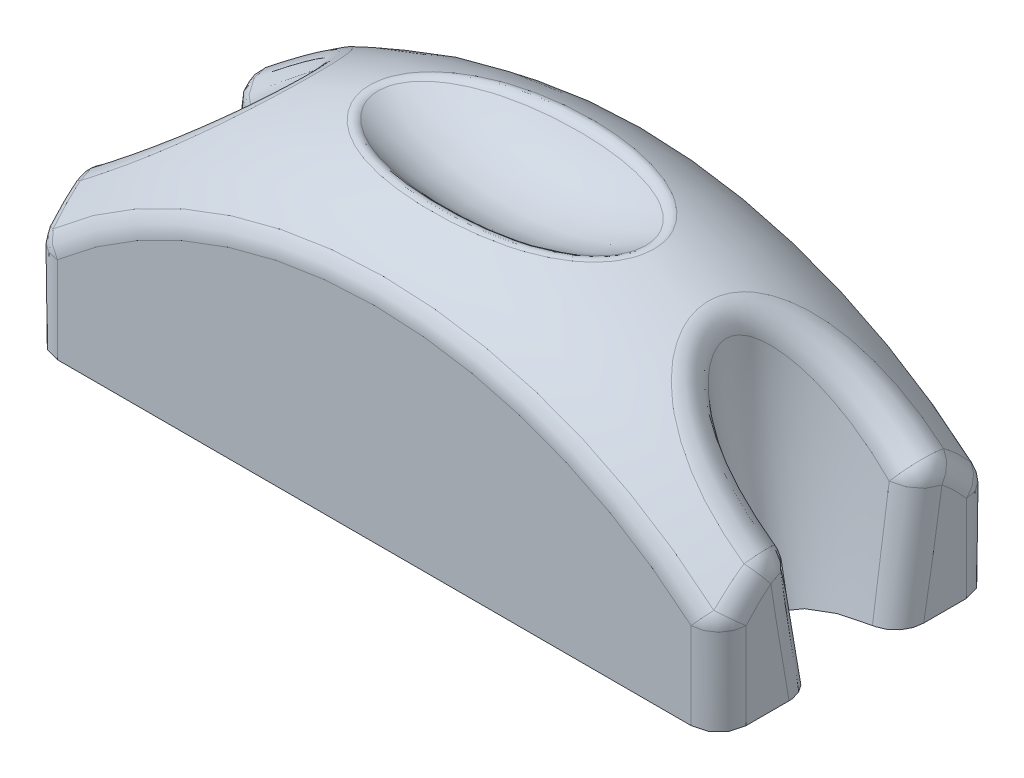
SolidWorks part; units mm, degrees
ref_plane "Front" through (0, 0, 0) normal (0, 0, 1) x (1, 0, 0)
ref_plane "Top" through (0, 0, 0) normal (0, 1, 0) x (1, 0, 0)
ref_plane "Right" through (0, 0, 0) normal (1, 0, 0) x (0, 0, -1)
sketch "Sketch1" plane through (0, 0, 0) normal (0, 1, 0) x (1, 0, 0)
  line L0 (62.5, 25) -> (-62.5, -25) construction
  line L1 (62.5, -25) -> (-62.5, -25)
  line L2 (62.5, -25) -> (62.5, 25)
  line L3 (62.5, 25) -> (-62.5, 25)
  line L4 (-62.5, -25) -> (-62.5, 25)
  dimension "D1" = 125
  dimension "D2" = 50
extrude "Extrude1" add sketch "Sketch1" along normal blind 50
sketch "Sketch2" plane through (0, 0, 0) normal (0, 0, 1) x (1, 0, 0)
  line L0 (62.5, 50) -> (62.5, 0) construction
  line L2 (-62.5, 0) -> (62.5, 0) construction
  line L4 (-62.5, 50) -> (-62.5, 0) construction
  arc A0 (62.5, 28) -> (-62.5, 28) centre (0, -50.0625) ccw
  dimension "D2" = 100
  dimension "D1" = 28
ref_plane "Plane1" through (62.5, 28, 0) normal (-0.7806, 0.625, 0) x (0, 0, 1)
sketch "Sketch3" plane through (62.5, 28, 0) normal (-0.7806, 0.625, 0) x (0, 0, 1)
  line L0 (-25, 17.1737) -> (-25, -60.9513) construction
  line L1 (25, -60.9513) -> (25, 17.1737) construction
  line L3 (-25, -10.5051) -> (-35.5007, -10.5051)
  line L4 (-35.5007, -10.5051) -> (-35.5007, 40.6396)
  line L5 (-35.5007, 40.6396) -> (37.2927, 40.6396)
  line L6 (37.2927, 40.6396) -> (37.2927, -10.5051)
  line L7 (37.2927, -10.5051) -> (25, -10.5051)
  arc A0 (-25, -10.5051) -> (25, -10.5051) centre (0, -35) cw
  dimension "D1" = 35
sweep "Cut-Sweep1" cut profiles "Sketch3" path "Sketch2"
sketch "Sketch4" plane through (0, 0, 0) normal (0, 1, 0) x (1, 0, 0)
  line L1 (62.5, -25) -> (62.5, 25) construction
  ellipse E0 centre (62.5, 0) end of major axis (47.5, 0) minor radius 7.5
  dimension "D1" = 30
  dimension "D2" = 15
ref_plane "Plane2" through (0, 50, 0) normal (0, 1, 0) x (-1, 0, 0)
sketch "Sketch5" plane through (0, 50, 0) normal (0, 1, 0) x (-1, 0, 0)
  line L0 (-62.5, 25) -> (-62.5, -25) construction
  ellipse E0 centre (-62.5, 0) end of major axis (-38.5, 0) minor radius 15
  dimension "D1" = 48
  dimension "D2" = 30
sketch "Sketch6" plane through (0, 0, 0) normal (0, 0, 1) x (1, 0, 0)
  arc A0 (47.5, 0) -> (38.5, 50) centre (178.4987, 49.3898) cw
  dimension "D1" = 140
loft "Cut-Loft2" cut profiles "Sketch4", "Sketch5"
mirror "Mirror1" about plane through (0, 0, 0) normal (1, 0, 0)
sketch "Sketch7" plane through (0, 0, 0) normal (0, 0, 1) x (1, 0, 0)
  arc A0 (-25, 46.7621) -> (25, 46.7621) centre (0, 90.0634) ccw
  arc A2 (38.6859, 42.1514) -> (-38.6859, 42.1514) centre (0, -50.0625) ccw construction
  dimension "D1" = 50
  dimension "D2" = 50
ref_plane "Plane3" through (-25, 46.7621, 0) normal (0.866, -0.5, 0) x (0, 0, -1)
sketch "Sketch8" plane through (-25, 46.7621, 0) normal (0.866, -0.5, 0) x (0, 0, -1)
  line L0 (-15, 15) -> (-26.5058, 15)
  line L1 (-26.5058, 15) -> (-26.5058, 28.2288)
  line L2 (-26.5058, 28.2288) -> (30.6363, 28.2288)
  line L3 (30.6363, 28.2288) -> (30.6363, 15)
  line L4 (30.6363, 15) -> (15, 15)
  arc A0 (-15, 15) -> (15, 15) centre (0, 15) ccw
  dimension "D1" = 15
  dimension "D2" = 30
  dimension "D3" = 15
sweep "Cut-Sweep2" cut profiles "Sketch8" path "Sketch7"
fillet "Fillet1" radius 5
fillet "Fillet2" radius 2
shell "Shell1" thickness 1.5
scale "Scale1" bodies to scale 105 scale about centroid uniform scaling yes scale factor 1
